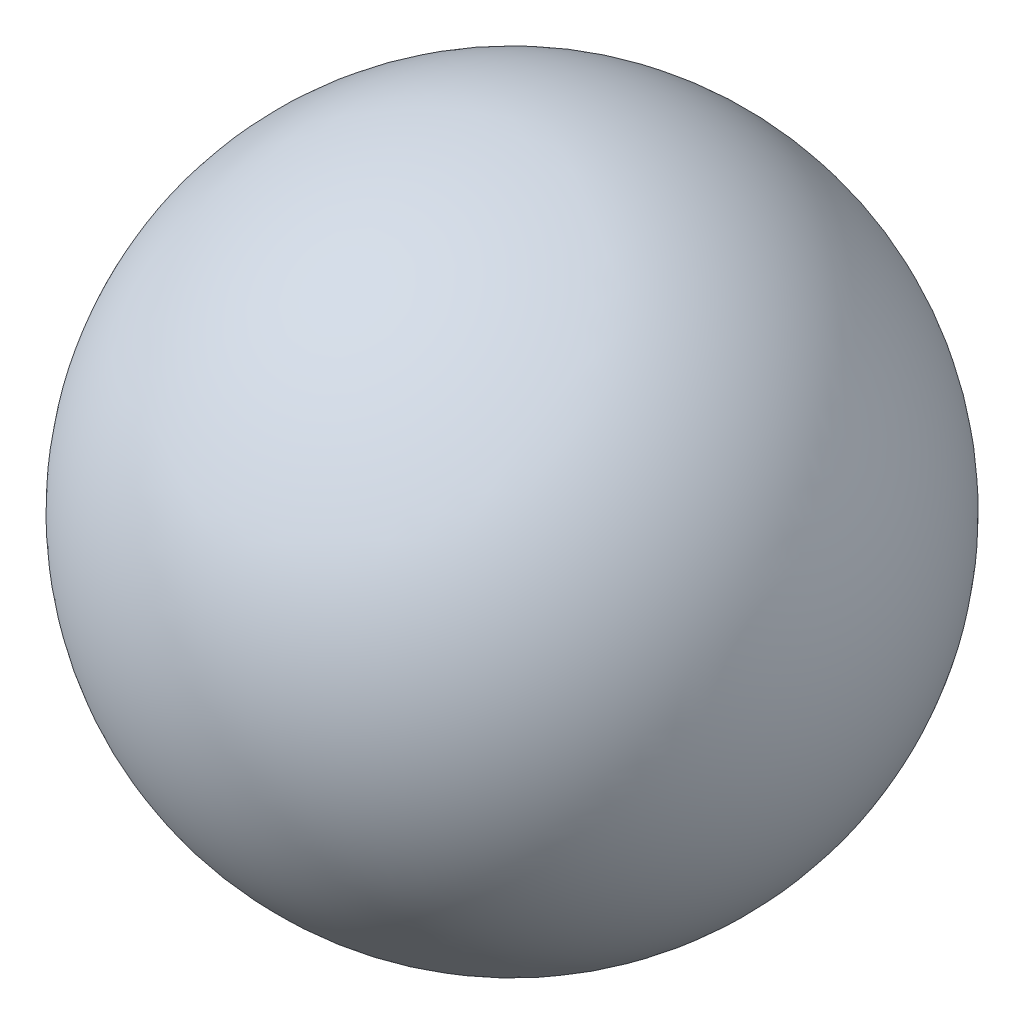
SolidWorks part; units mm, degrees
ref_plane "Front Plane" through (0, 0, 0) normal (0, 0, 1) x (1, 0, 0)
ref_plane "Top Plane" through (0, 0, 0) normal (0, 1, 0) x (1, 0, 0)
ref_plane "Right Plane" through (0, 0, 0) normal (1, 0, 0) x (0, 0, -1)
sketch "Sketch1" plane through (0, 0, 0) normal (0, 0, 1) x (1, 0, 0)
  line L0 (0, 0) -> (25.4, 0)
  line L1 (0, 0) -> (-25.4, 0)
  arc A0 (25.4, 0) -> (-25.4, 0) centre (0, 0) ccw
  dimension "D1" = 50.8
revolve "Revolve1" add sketch "Sketch1" angle 360 about L1
